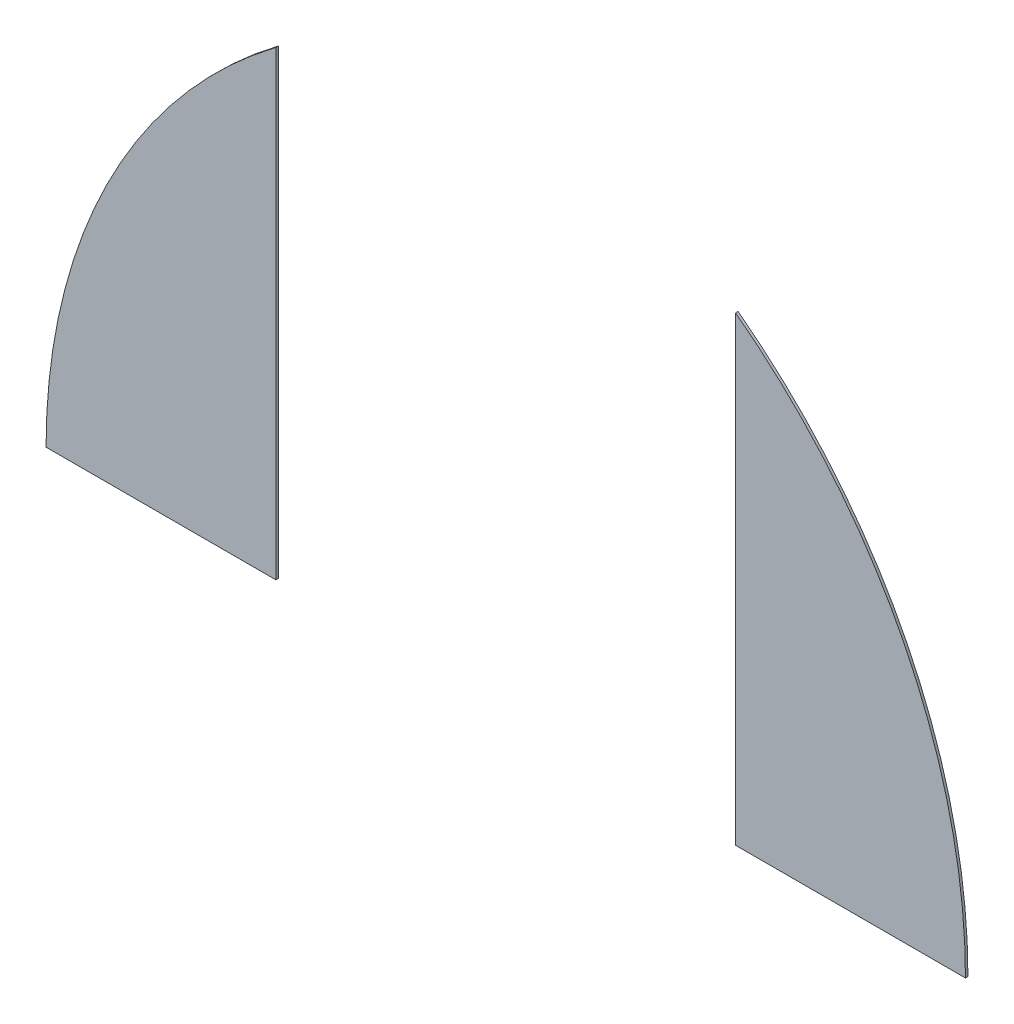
SolidWorks part; units mm, degrees
ref_plane "Alzado" through (0, 0, 0) normal (0, 0, 1) x (1, 0, 0)
ref_plane "Planta" through (0, 0, 0) normal (0, 1, 0) x (1, 0, 0)
ref_plane "Vista lateral" through (0, 0, 0) normal (1, 0, 0) x (0, 0, -1)
sketch "Croquis1" plane through (0, 0, 0) normal (0, 0, 1) x (1, 0, 0)
  line L6 (-1310.0124, -678.0133) -> (-660.0124, -678.0133)
  line L7 (639.9876, 625.9988) -> (639.9876, -678.0133)
  line L8 (-660.0124, 625.9988) -> (-660.0124, -678.0133)
  line L9 (1289.9876, -678.0133) -> (639.9876, -678.0133)
  arc A2 (-1310.0124, -678.0133) -> (-660.0124, 625.9988) centre (323.0241, -678.0133) cw
  arc A4 (1289.9876, -678.0133) -> (639.9876, 625.9988) centre (-343.0489, -678.0133) ccw
extrude "Saliente-Extruir1" add sketch "Croquis1" along normal blind 7
